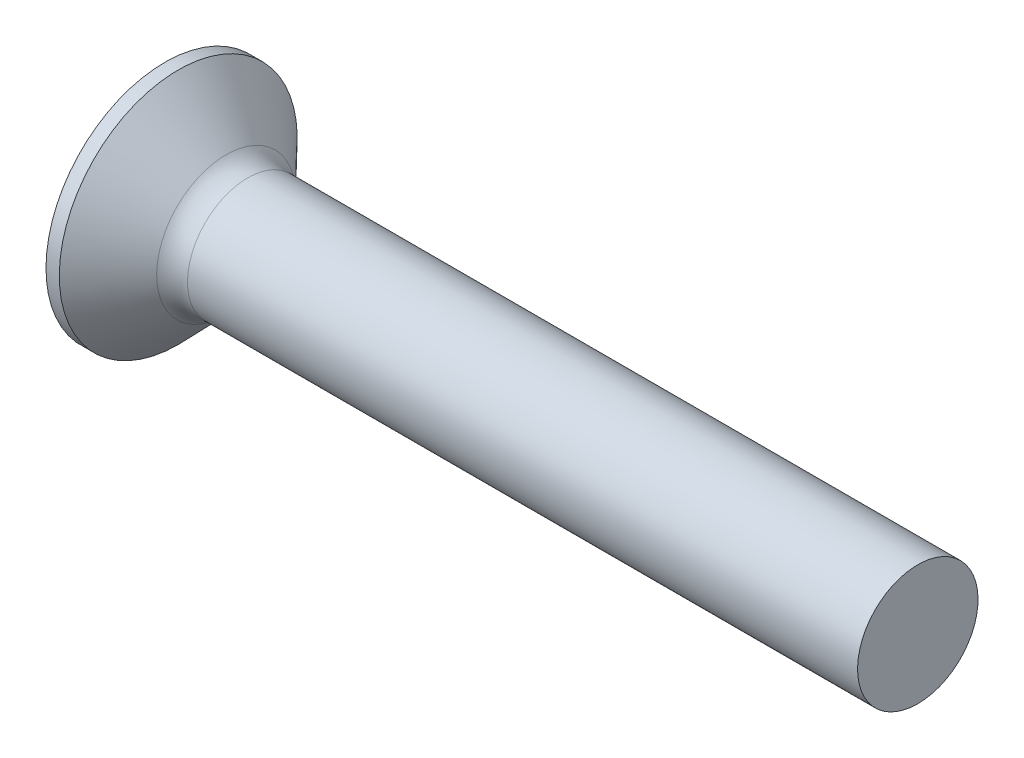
SolidWorks part; units mm, degrees
ref_plane "Front Plane" through (0, 0, 0) normal (0, 0, 1) x (1, 0, 0)
ref_plane "Top Plane" through (0, 0, 0) normal (0, 1, 0) x (1, 0, 0)
ref_plane "Right Plane" through (0, 0, 0) normal (1, 0, 0) x (0, 0, -1)
other "Configuration Table"
sketch "BodySke" plane through (0, 0, 0) normal (0, 0, 1) x (1, 0, 0)
  line L0 (2.0141, 0) -> (111.3824, 0) construction
  line L1 (2.0141, 0) -> (2.0141, 7.9) construction
  line L2 (2.0141, 7.9) -> (2.898, 7.9)
  line L3 (2.898, 7.9) -> (6.6641, 4)
  line L4 (6.6641, 4) -> (52.0141, 4)
  line L5 (52.0141, 4) -> (52.0141, 0)
  line L6 (7.9141, 1.8551) -> (7.9141, -12.8628) construction
  line L7 (2.0141, 0) -> (52.0141, 0)
  line L8 (9.1641, 2.7551) -> (9.1641, -11.0269) construction
  line L9 (2.0141, -7.9) -> (2.898, -7.9) construction
  line L10 (2.898, -7.9) -> (6.6641, -4) construction
  line L11 (6.6641, -4) -> (52.0141, -4) construction
  line L12 (2.0141, 0) -> (-7.747, 0) construction
  line L13 (0, 0) -> (0, 16.1338) construction
  line L14 (2.0141, 0) -> (0, 0)
  arc A0 (0, 0) -> (2.0141, 7.9) centre (16.5, 0) cw
  point P10 (52.0141, 3.4455)
revolve "BaseBody" add sketch "BodySke" angle 360 about L0
fillet "Fillet1" radius 2 1 edges at (6.6641, -4, 0)
ref_plane "Plane1" through (5.18, 0, 0) normal (1, 0, 0) x (0, 0, -1)
sketch "RecSkeTop" plane through (0, 0, 0) normal (1, 0, 0) x (0, 0, -1)
  line L1 (-0.946, 4.3) -> (0.946, 4.3)
  line L2 (-0.946, 4.3) -> (-0.946, -4.3)
  line L3 (-0.946, -4.3) -> (0.946, -4.3)
  line L4 (0.946, 4.3) -> (0.946, -4.3)
sketch "RecSkeBot" plane through (5.18, 0, 0) normal (1, 0, 0) x (0, 0, -1)
  line L0 (-0.946, 4.3) -> (-0.946, -4.3) construction
  line L1 (-0.946, 1.7173) -> (0.946, 1.7173)
  line L2 (-0.946, 1.7173) -> (-0.946, -1.7173)
  line L3 (-0.946, -1.7173) -> (0.946, -1.7173)
  line L4 (0.946, 1.7173) -> (0.946, -1.7173)
  line L5 (0.946, 4.3) -> (0.946, -4.3) construction
loft "Recess" cut profiles "RecSkeTop", "RecSkeBot"
pattern_circular "RecPat" count 2 every 90 about axis through (0, 0, 0) along (1, 0, 0) of "Recess"
sketch "RecCorSke" plane through (0, 0, 0) normal (0, 0, 1) x (1, 0, 0)
  line L0 (0, 0) -> (57.5987, 0) construction
  line L1 (0, 0) -> (0, 2.0812)
  line L3 (0, 2.0812) -> (5.18, 1.719)
  line L4 (5.18, 1.719) -> (5.7385, 0)
  line L5 (5.7385, 0) -> (0, 0)
revolve "RecessCore" cut sketch "RecCorSke" angle 360 about L0
sketch "ThdSchSke" plane through (0, 0, 0) normal (0, 0, 1) x (1, 0, 0)
  line L0 (0, 0) -> (55.1256, 0) construction
  line L1 (2.0141, 0) -> (111.3824, 0) construction
  line L2 (51.694, 4) -> (51.694, 4.6403)
  line L3 (51.694, 4.6403) -> (52.3343, 4.6403)
  line L4 (52.3343, 4.6403) -> (52.3343, 4)
  line L5 (52.3343, 4) -> (52.0141, 3.4455)
  line L6 (52.0141, 3.4455) -> (51.694, 4)
  line L7 (6.6641, 4) -> (52.0141, 4) construction
  line L13 (52.0141, 4) -> (52.0141, 0) construction
revolve "ThreadSchematic" [suppressed] cut sketch "ThdSchSke" angle 360 about L0
pattern_linear "ThdSchPat" [suppressed] count 35 along (1, 0, 0)
equation "\"Thread_minor@ThreadCosmetic\" = \"Thread_minor@BodySke\""
equation "\"D1@RecSkeTop\" = \"Cross_dia@RecSkeTop\" / 2"
equation "\"D2@RecSkeTop\" = \"Cross_dia@RecSkeTop\" * 0.22"
equation "\"D3@RecSkeTop\" = \"D2@RecSkeTop\" / 2"
equation "\"D1@RecSkeBot\" = \"Cross_dia@RecSkeTop\" - 2 * \"Cross_depth@Plane1\" *  tan( 26.5 * 0.017453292 ) "
equation "\"D2@RecSkeBot\" = \"D1@RecSkeBot\" / 2"
equation "\"D2@RecCorSke\" = \"Cross_depth@Plane1\""
equation "\"D3@RecCorSke\" = \"D2@RecSkeTop\" * 1.1"
equation "\"Advance@ThdSchPat\" = \"Advance@BodySke\""
equation "\"D1@ThdSchPat\" =  int(  ( \"Length@BodySke\"-\"Head_height@BodySke\"-\"Tread_runout@BodySke\" )  / \"Advance@ThdSchPat\" )  + 1"
